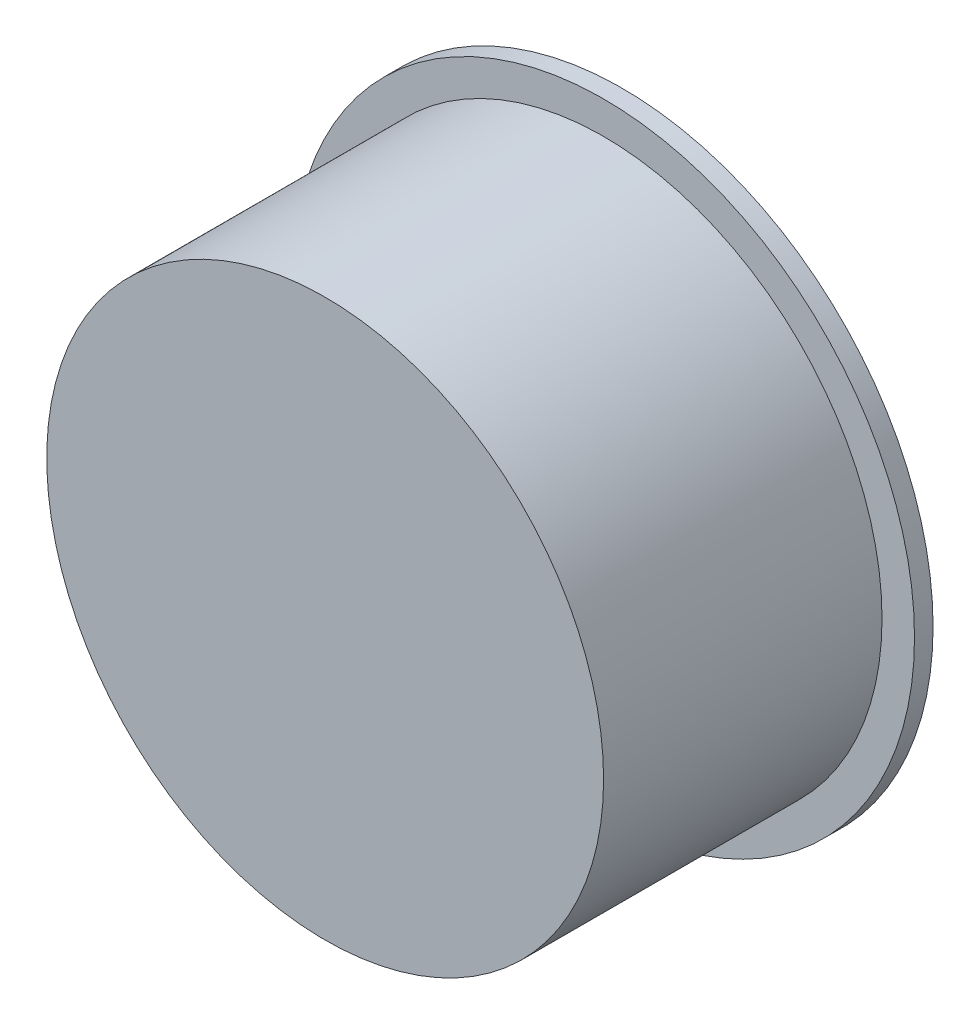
SolidWorks part; units mm, degrees
ref_plane "Alzado" through (0, 0, 0) normal (0, 0, 1) x (1, 0, 0)
ref_plane "Planta" through (0, 0, 0) normal (0, 1, 0) x (1, 0, 0)
ref_plane "Vista lateral" through (0, 0, 0) normal (1, 0, 0) x (0, 0, -1)
sketch "Croquis1" plane through (0, 0, 0) normal (0, 0, 1) x (1, 0, 0)
  circle A0 centre (0, 0) radius 33.5
  dimension "D1" = 67
extrude "Saliente-Extruir1" add sketch "Croquis1" along normal blind 2
sketch "Croquis2" plane through (0, 0, 2) normal (0, 0, 1) x (1, 0, 0)
  circle A0 centre (0, 0) radius 30
extrude "Saliente-Extruir2" add sketch "Croquis2" along normal blind 30
sketch "Croquis3" plane through (0, 0, 32) normal (0, 0, 1) x (1, 0, 0)
  circle A0 centre (0, 0) radius 27.5
extrude "Cortar-Extruir1" cut sketch "Croquis3" against normal up to surface (30 mm away)
sketch "Croquis4" plane through (0, 0, 0) normal (0, 0, -1) x (-1, 0, 0)
  line L0 (0, -7.1497) -> (0, 7.1497) construction
  line L1 (-5.4508, -7.1497) -> (-5.4508, 7.1497)
  line L2 (5.4508, -7.1497) -> (5.4508, 7.1497)
  arc A0 (-5.4508, -7.1497) -> (5.4508, -7.1497) centre (0, -7.1497) ccw
  arc A1 (5.4508, 7.1497) -> (-5.4508, 7.1497) centre (0, 7.1497) ccw
  point P2 (0, 0)
extrude "Cortar-Extruir2" cut sketch "Croquis4" against normal blind 4
sketch "Croquis5" plane through (0, 0, 32) normal (0, 0, 1) x (1, 0, 0)
  circle A1 centre (0, 0) radius 30
  circle A2 centre (0, 0) radius 30
  dimension "D1" = 0
extrude "Saliente-Extruir3" add sketch "Croquis5" against normal blind 2
sketch "Croquis6" plane through (0, 0, 30) normal (0, 0, -1) x (-1, 0, 0)
  circle A0 centre (0, 0) radius 7.5
extrude "Saliente-Extruir4" add sketch "Croquis6" along normal blind 16
